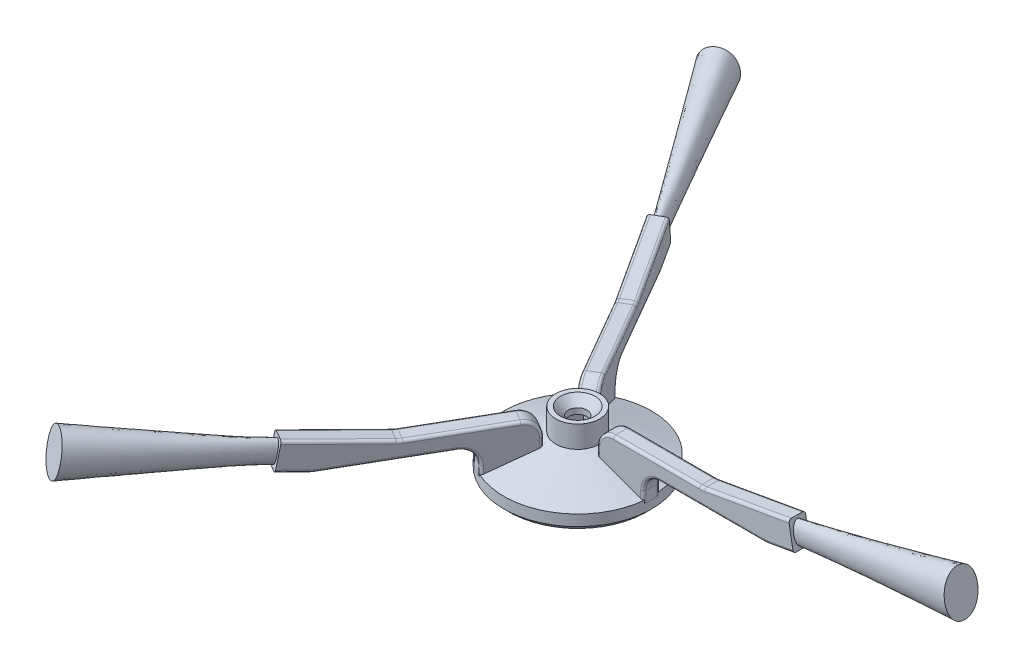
SolidWorks part; units mm, degrees
ref_plane "Face" through (0, 0, 0) normal (0, 0, 1) x (1, 0, 0)
ref_plane "Dessus" through (0, 0, 0) normal (0, 1, 0) x (1, 0, 0)
ref_plane "Droite" through (0, 0, 0) normal (1, 0, 0) x (0, 0, -1)
sketch "Esquisse1" plane through (0, 0, 0) normal (0, 0, 1) x (1, 0, 0)
  line L0 (0, 0) -> (0, 17.8546) construction
  line L1 (0, 0) -> (9.5, 0)
  line L2 (9.5, 0) -> (9.5, 2)
  line L3 (9.5, 2) -> (12.5, 2)
  line L4 (13.5, 3) -> (13.5, 5)
  line L5 (12.5, 2) -> (13.5, 3)
  line L6 (13.5, 5) -> (4, 8.5)
  line L7 (4, 8.5) -> (4, 12.5)
  line L8 (4, 12.5) -> (0, 12.5)
  line L9 (0, 12.5) -> (0, 0)
  point P5 (13.5, 2)
  dimension "D1" = 19
  dimension "D2" = 2
  dimension "D3" = 27
  dimension "D4" = 3
  dimension "D7" = 1
  dimension "D5" = 8
  dimension "D6" = 4
  dimension "D8" = 3.5
revolve "Cône de base" add sketch "Esquisse1" angle 360 about L0
sketch "Esquisse2" plane through (0, 0, 0) normal (0, -1, 0) x (1, 0, 0)
  line L1 (1.4434, -2.5) -> (2.8868, 0)
  line L2 (2.8868, 0) -> (1.4434, 2.5)
  line L3 (1.4434, 2.5) -> (-1.4434, 2.5)
  line L4 (-1.4434, 2.5) -> (-2.8868, 0)
  line L5 (-2.8868, 0) -> (-1.4434, -2.5)
  line L6 (-1.4434, -2.5) -> (1.4434, -2.5)
  circle A0 centre (0, 0) radius 2.5 construction
  dimension "D1" = 5
extrude "Enlèv. mat.-Extru.1" cut sketch "Esquisse2" against normal blind 10
sketch "Esquisse21" plane through (0.5522, 12.5, -0.2671) normal (0, 1, 0) x (-1, 0, 0)
  circle A0 centre (0.5522, 0.2671) radius 1.7
  circle A1 centre (0.5522, 0.2671) radius 4 construction
  dimension "D1" = 3.4
extrude "Trou" cut sketch "Esquisse21" against normal through all
sketch "Esquisse3" plane through (0.5522, 12.5, -0.2671) normal (0, 1, 0) x (-1, 0, 0)
  circle A0 centre (0.5522, 0.2671) radius 3.15
  circle A1 centre (0.5522, 0.2671) radius 1.7 construction
  dimension "D1" = 6.3
extrude "Lamage" cut sketch "Esquisse3" against normal blind 3.5 draft 45
other "Trou F901"
sketch "Esquisse22" plane through (0, 0, 0) normal (0, 0, 1) x (1, 0, 0)
  line L0 (5, 7.5987) -> (5, 9.5)
  line L1 (8, 12.5) -> (24.1642, 12.5)
  line L2 (13.5, 4.4671) -> (13.5, 6.5)
  line L4 (4, 12.5) -> (-4, 12.5) construction
  line L5 (13.5, 3) -> (13.5, 5) construction
  line L6 (0, 0) -> (0, 17.8546) construction
  line L7 (13.5, 4.4671) -> (5, 7.5987)
  line L8 (13.5, 5) -> (4, 8.5) construction
  line L9 (16.5, 9.5) -> (35.9442, 9.5)
  line L10 (24.1642, 12.5) -> (40, 15.2923)
  line L11 (40, 15.2923) -> (40.8682, 10.3682)
  line L12 (40.8682, 10.3682) -> (35.9442, 9.5)
  arc A0 (5, 9.5) -> (8, 12.5) centre (8, 9.5) cw
  arc A1 (13.5, 6.5) -> (16.5, 9.5) centre (16.5, 6.5) cw
  dimension "D4" = 3
  dimension "D5" = 3
  dimension "D1" = 5
  dimension "D2" = 0.5
  dimension "D3" = 3
  dimension "D6" = 5
  dimension "D7" = 40
  dimension "D8" = 5
  dimension "D9" = 10
extrude "Extrusion1" add sketch "Esquisse22" along normal mid plane 3
pattern_circular "Répétition circulaire1" count 3 over 360 about axis through (0, 0, 0) along (0, 1, 0) of "Extrusion1"
fillet "Congé1" radius 5 4 edges at (35.9442, 9.5, 0) (24.1642, 12.5, 0) (-17.9721, 9.5, -31.1286) (-12.0821, 12.5, -20.9268)
fillet "Congé2" radius 0.5 40 edges at (13.5, 5.4836, -1.5) (14.3787, 8.6213, -1.5) (38.6216, 9.9721, -1.5) (35.9425, 9.519, -1.5) (13.5, 5.4836, 1.5) (14.3787, 8.6213, 1.5) (38.6216, 9.9721, 1.5) (35.9425, 9.519, 1.5) (32.2975, 13.9341, -1.5) (24.1625, 12.519, -1.5) (5, 8.7752, -1.5) (5.8787, 11.6213, -1.5) (32.2975, 13.9341, 1.5) (24.1625, 12.519, 1.5) (5, 8.7752, 1.5) (5.8787, 11.6213, 1.5) (26.0034, 9.5, -1.5) (26.0034, 9.5, 1.5) (15.8634, 12.5, -1.5) (15.8634, 12.5, 1.5) (-8.049, 5.4836, -10.9413) (-8.4884, 8.6213, -11.7023) (-20.6098, 9.9721, -32.6973) (-19.2703, 9.519, -30.3772) (-5.451, 5.4836, -12.4413) (-5.8903, 8.6213, -13.2023) (-11.7027, 9.5, -23.2696) (-16.6722, 9.519, -31.8772) (-1.201, 8.7752, -5.0801) (-1.6403, 11.6213, -5.8411) (-6.6326, 12.5, -14.4881) (-10.7822, 12.519, -21.6754) (-3.799, 8.7752, -3.5801) (-4.2384, 11.6213, -4.3411) (-9.2307, 12.5, -12.9881) (-13.3803, 12.519, -20.1754) (-14.3007, 9.5, -21.7696) (-18.0118, 9.9721, -34.1973) (-14.8497, 13.9341, -28.7205) (-17.4478, 13.9341, -27.2205)
ref_plane "Plan1" through (70.9532, 12.511, 0) normal (0.9848, 0.1736, 0) x (0, 0, -1)
sketch "Esquisse23" plane through (41.409, 7.3015, 0) normal (0.9848, 0.1736, 0) x (0, 0, -1)
  line L0 (0, 5.614) -> (0, 8.114) construction
  line L1 (-1, 8.114) -> (1, 8.114) construction
  line L2 (0, 5.614) -> (0, 3.114) construction
  line L3 (-1, 3.114) -> (1, 3.114) construction
  ellipse E0 centre (0, 5.614) end of major axis (0, 7.614) minor radius 1
  dimension "D1" = 4
  dimension "D2" = 2
sketch "Esquisse24" plane through (70.9532, 12.511, 0) normal (0.9848, 0.1736, 0) x (0, 0, -1)
  point P16 (0, 1.614)
  dimension "D1" = 2
loft "Lissage1" add profiles "Esquisse23", "Esquisse24"
pattern_circular "Répétition circulaire2" count 3 over 360 about axis through (0, 0, 0) along (0, 1, 0) of "Lissage1"
fillet "Congé3" radius 5 2 edges at (-17.9721, 9.5, 31.1286) (-12.0821, 12.5, 20.9268)
fillet "Congé7" radius 0.5 5 edges at (-3.799, 8.7752, 3.5801) (-4.2384, 11.6213, 4.3411) (-17.4478, 13.9341, 27.2205) (-13.3803, 12.519, 20.1754) (-9.2307, 12.5, 12.9881)
fillet "Congé8" radius 0.5 5 edges at (-1.201, 8.7752, 5.0801) (-1.6403, 11.6213, 5.8411) (-6.6326, 12.5, 14.4881) (-10.7822, 12.519, 21.6754) (-14.8497, 13.9341, 28.7205)
fillet "Congé9" radius 0.5 5 edges at (-18.0118, 9.9721, 34.1973) (-16.6722, 9.519, 31.8772) (-5.451, 5.4836, 12.4413) (-5.8903, 8.6213, 13.2023) (-11.7027, 9.5, 23.2696)
fillet "Congé10" radius 0.5 5 edges at (-20.6098, 9.9721, 32.6973) (-19.2703, 9.519, 30.3772) (-8.049, 5.4836, 10.9413) (-8.4884, 8.6213, 11.7023) (-14.3007, 9.5, 21.7696)
